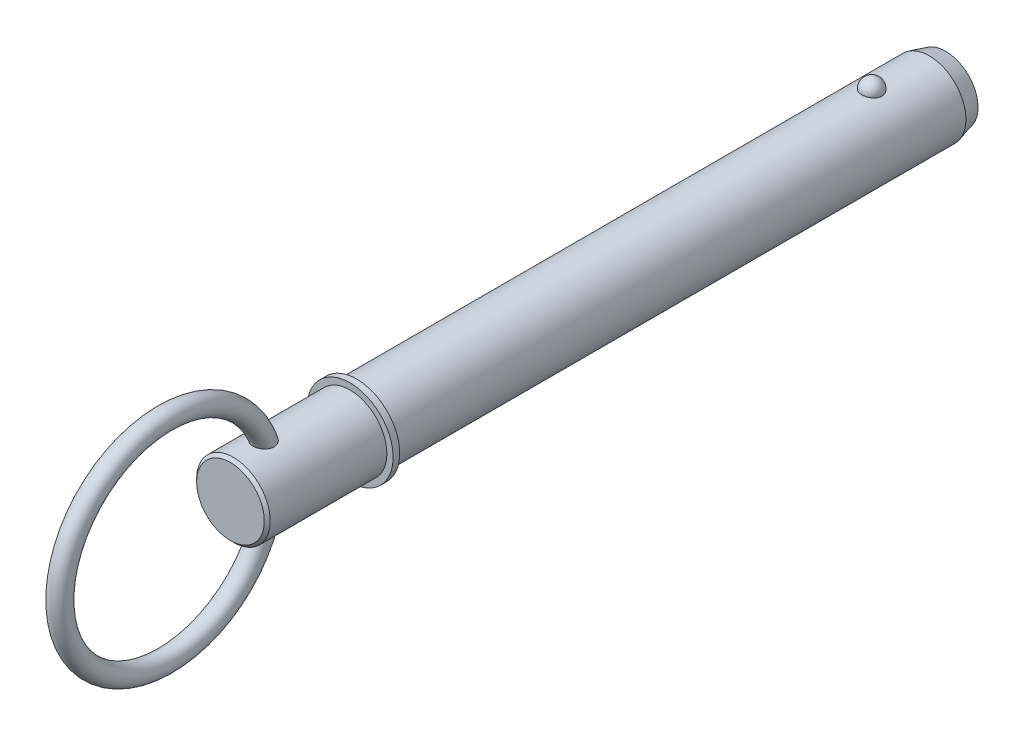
SolidWorks part; units mm, degrees
ref_plane "Front Plane" through (0, 0, 0) normal (0, 0, 1) x (1, 0, 0)
ref_plane "Top Plane" through (0, 0, 0) normal (0, 1, 0) x (1, 0, 0)
ref_plane "Right Plane" through (0, 0, 0) normal (1, 0, 0) x (0, 0, -1)
sketch "Sketch2" plane through (0, 0, 0) normal (0, 0, 1) x (1, 0, 0)
  circle A0 centre (0, 0) radius 11.115
  point P3 (0, 11.115)
  dimension "D1" = 22.23
extrude "Boss-Extrude1" add sketch "Sketch2" along normal blind 152.4
sketch "Sketch3" plane through (0, 0, 0) normal (0, 0, -1) x (-1, 0, 0)
  circle A0 centre (0, 0) radius 11.115
  dimension "D1" = 22.23
extrude "Boss-Extrude2" add sketch "Sketch3" along normal blind 25.4
chamfer "Chamfer1" distance 5 angle 15 1 edges at (-11.115, 0, -25.4)
sketch "Sketch18" plane through (0, 0, 0) normal (1, 0, 0) x (0, 0, -1)
  line L0 (20.4, 11.115) -> (-152.4, 11.115) construction
  line L1 (3.07, 14.185) -> (3.07, 8.045)
  line L2 (-152.4, -11.115) -> (20.4, -11.115) construction
  arc A0 (3.07, 14.185) -> (3.07, 8.045) centre (3.07, 11.115) ccw
  point P4 (0, 11.115)
  dimension "D1" = 25.3
revolve "Revolve1" add sketch "Sketch18" angle 360 about L1
sketch "Sketch19" plane through (0, 0, 0) normal (1, 0, 0) x (0, 0, -1)
  line L0 (-33.7288, 0) -> (-46.4542, 0) construction
sketch "Sketch20" plane through (0, 0, 0) normal (1, 0, 0) x (0, 0, -1)
  line L0 (-152.4, 0) -> (-152.4, 13)
  line L1 (-152.4, 11.115) -> (-152.4, -11.115) construction
  line L2 (-152.4, 13) -> (-154.4, 13)
  line L3 (-154.4, 13) -> (-154.4, 0)
  line L4 (-33.7288, 0) -> (-46.4542, 0) construction
  line L5 (-154.4, 0) -> (-152.4, 0)
  dimension "D1" = 13
  dimension "D2" = 2
revolve "Revolve2" add sketch "Sketch20" angle 360 about L0
sketch "Sketch21" plane through (0, 0, 152.4) normal (0, 0, -1) x (-1, 0, 0)
  circle A0 centre (0, 0) radius 11.115
  dimension "D1" = 22.23
extrude "Boss-Extrude3" add sketch "Sketch21" against normal blind 38.1
chamfer "Chamfer2" distance 0.9 angle 45 1 edges at (-11.115, 0, 190.5)
sketch "Sketch23" plane through (0, 0, 0) normal (1, 0, 0) x (0, 0, -1)
  line L0 (-190.5, 10.215) -> (-190.5, -10.215) construction
  circle A0 centre (-210.25, 0) radius 31.75
  point P2 (-178.5, 0)
  dimension "D1" = 63.5
  dimension "D2" = 12
sketch "Sketch24" plane through (0, 0, 0) normal (0, 1, 0) x (1, 0, 0)
  circle A0 centre (0, -178.5) radius 3
  dimension "D1" = 6
sweep "Sweep1" add profiles "Sketch24" path "Sketch23"
